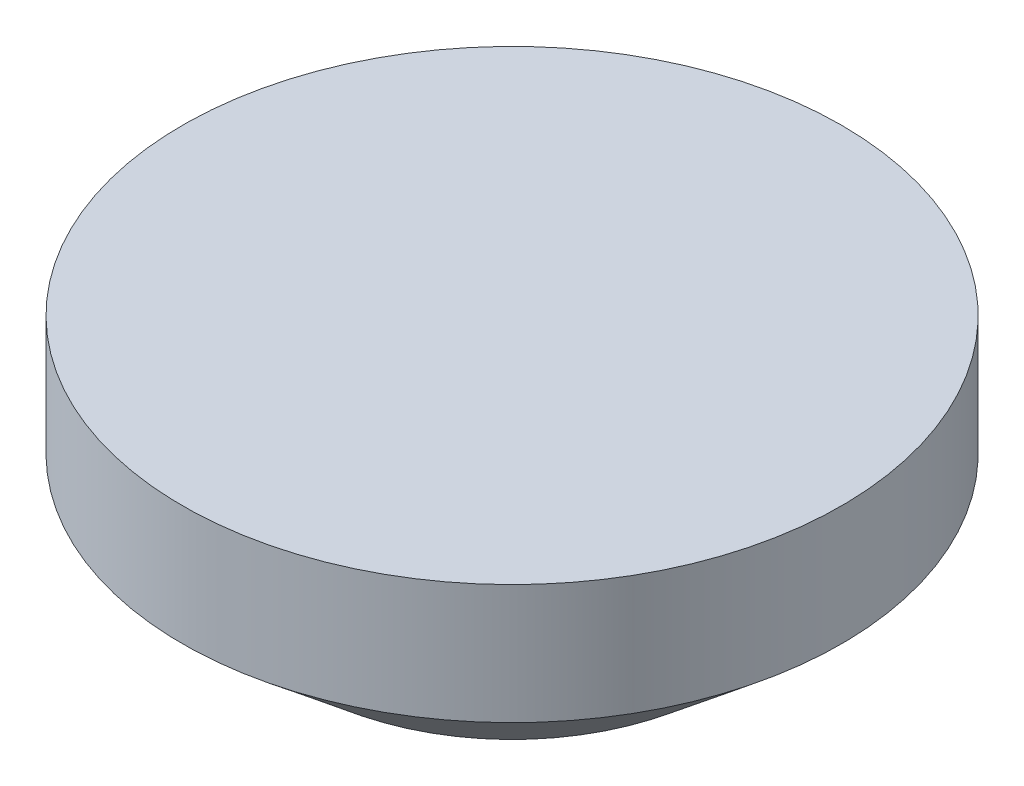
SolidWorks part; units mm, degrees
ref_plane "前视基准面" through (0, 0, 0) normal (0, 0, 1) x (1, 0, 0)
ref_plane "上视基准面" through (0, 0, 0) normal (0, 1, 0) x (1, 0, 0)
ref_plane "右视基准面" through (0, 0, 0) normal (1, 0, 0) x (0, 0, -1)
sketch "草图1" plane through (0, 0, 0) normal (0, 0, 1) x (1, 0, 0)
  line L0 (0, 0) -> (0, 528.9135) construction
  line L1 (0, 375) -> (565, 375)
  line L2 (565, 375) -> (565, 170)
  line L3 (565, 170) -> (360, 0)
  line L4 (360, 0) -> (0, 0)
  line L5 (0, 0) -> (0, 375)
  dimension "D1" = 205
  dimension "D2" = 170
  dimension "D3" = 1130
  dimension "D4" = 720
revolve "旋转1" add sketch "草图1" angle 360 about L0
